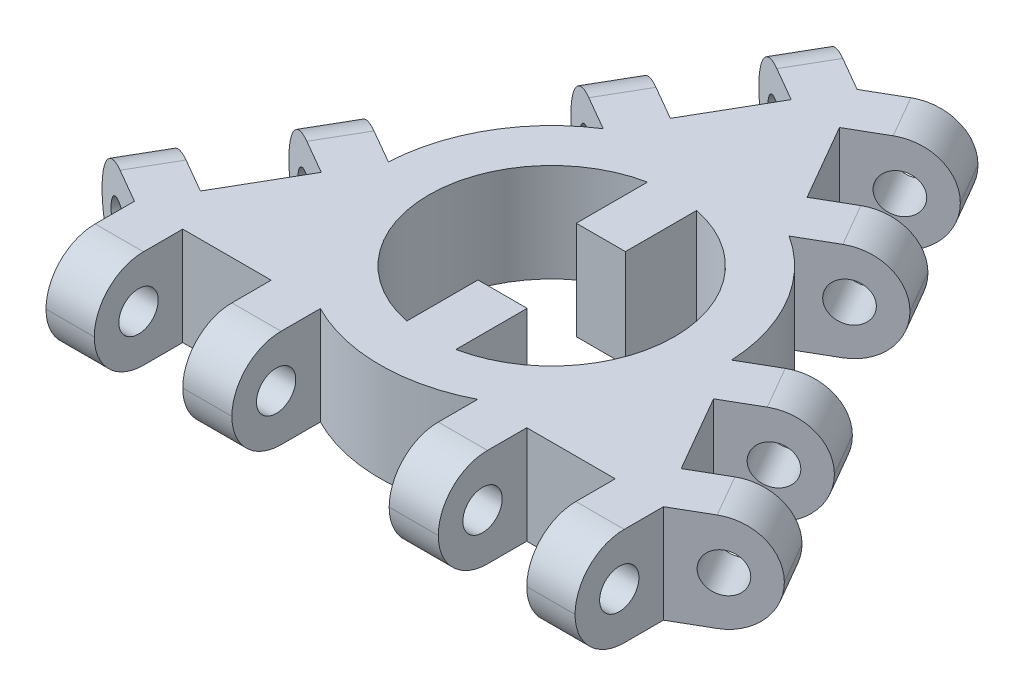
SolidWorks part; units mm, degrees
ref_plane "Ebene vorne" through (0, 0, 0) normal (0, 0, 1) x (1, 0, 0)
ref_plane "Ebene oben" through (0, 0, 0) normal (0, 1, 0) x (1, 0, 0)
ref_plane "Ebene rechts" through (0, 0, 0) normal (1, 0, 0) x (0, 0, -1)
sketch "Skizze4" plane through (0, 0, 0) normal (0, 1, 0) x (1, 0, 0)
  line L0 (-12.5, 125.5737) -> (-72.5, 21.6506)
  line L1 (12.5, 125.5737) -> (72.5, 21.6506)
  line L3 (-60, 0) -> (60, 0)
  line L4 (-12.5, 125.5737) -> (12.5, 125.5737)
  line L5 (-72.5, 21.6506) -> (-60, 0)
  line L6 (60, 0) -> (72.5, 21.6506)
  dimension "D1" = 25
  dimension "D2" = 120
extrude "Aufsatz-Linear austragen4" add sketch "Skizze4" along normal blind 20
sketch "Skizze5" plane through (0, 0, 0) normal (0, 0, 1) x (1, 0, 0)
  line L1 (-60, 20) -> (60, 20) construction
  line L2 (-44, 20) -> (-44, 0)
  line L3 (-60, 0) -> (60, 0) construction
  line L4 (-44, 0) -> (-26, 0)
  line L5 (-26, 0) -> (-26, 20)
  line L6 (-26, 20) -> (-44, 20)
  line L7 (26, 20) -> (26, 0)
  line L8 (26, 0) -> (44, 0)
  line L9 (44, 0) -> (44, 20)
  line L10 (44, 20) -> (26, 20)
  dimension "D1" = 52
  dimension "D2" = 18
  dimension "D3" = 18
extrude "Schnitt-Linear austragen3" cut sketch "Skizze5" against normal blind 18
sketch "Skizze7" plane through (63.75, 0, -36.8061) normal (0.866, 0, -0.5) x (-0.5, 0, -0.866)
  line L1 (-17.5, 20) -> (102.5, 20) construction
  line L2 (-1.5, 20) -> (-1.5, 0)
  line L3 (-17.5, 0) -> (102.5, 0) construction
  line L4 (-1.5, 0) -> (16.5, 0)
  line L5 (16.5, 0) -> (16.5, 20)
  line L6 (16.5, 20) -> (-1.5, 20)
  line L7 (68.5, 20) -> (86.5, 20)
  line L8 (86.5, 20) -> (86.5, 0)
  line L9 (86.5, 0) -> (68.5, 0)
  line L10 (68.5, 0) -> (68.5, 20)
  dimension "D1" = 52
  dimension "D2" = 18
  dimension "D3" = 18
extrude "Schnitt-Linear austragen4" cut sketch "Skizze7" against normal blind 18
sketch "Skizze8" plane through (0, 20, 0) normal (0, 1, 0) x (1, 0, 0)
  line L4 (72.5, 21.6506) -> (60, 14.4338)
  line L5 (60, 0) -> (60, 14.4338)
extrude "Schnitt-Linear austragen5" cut sketch "Skizze8" against normal through all and the other way through all
sketch "Skizze9" plane through (-63.75, 0, -36.8061) normal (-0.866, 0, -0.5) x (-0.5, 0, 0.866)
  line L1 (-102.5, 20) -> (17.5, 20) construction
  line L2 (-86.5, 20) -> (-86.5, 0)
  line L3 (-102.5, 0) -> (17.5, 0) construction
  line L4 (-86.5, 0) -> (-68.5, 0)
  line L5 (-68.5, 0) -> (-68.5, 20)
  line L6 (-68.5, 20) -> (-86.5, 20)
  line L7 (-16.5, 20) -> (1.5, 20)
  line L8 (1.5, 20) -> (1.5, 0)
  line L9 (1.5, 0) -> (-16.5, 0)
  line L10 (-16.5, 0) -> (-16.5, 20)
  dimension "D1" = 52
  dimension "D2" = 18
  dimension "D3" = 18
extrude "Schnitt-Linear austragen6" cut sketch "Skizze9" against normal blind 18
sketch "Skizze10" plane through (0, 20, 0) normal (0, 1, 0) x (1, 0, 0)
  line L0 (-60, 14.4338) -> (-72.5, 21.6506)
  line L5 (-60, 0) -> (-60, 14.4338)
extrude "Schnitt-Linear austragen7" cut sketch "Skizze10" against normal through all and the other way through all
sketch "Skizze11" plane through (0, 20, 0) normal (0, 1, 0) x (1, 0, 0)
  line L0 (0, 118.3568) -> (-12.5, 125.5737)
  line L2 (-12.5, 125.5737) -> (12.5, 125.5737)
  line L6 (12.5, 125.5737) -> (0, 118.3568)
extrude "Schnitt-Linear austragen10" cut sketch "Skizze11" against normal blind 20
sketch "Skizze12" plane through (0, 20, 0) normal (0, 1, 0) x (1, 0, 0)
  line L0 (-53.8231, 18) -> (-53.8231, 0)
  line L2 (-56.7058, 31.007) -> (-48.9115, 26.507)
  line L3 (-48.9115, 26.507) -> (-64.5, 35.507) construction
  line L4 (-60, 0) -> (-44, 0) construction
  line L5 (-53.8231, 18) -> (-69.4115, 27)
  line L6 (-64.5, 35.507) -> (-72.5, 21.6506) construction
  line L7 (-53.8231, 0) -> (-60, 0)
  line L8 (-60, 0) -> (-60, 14.4338)
  line L9 (-60, 14.4338) -> (-72.5, 21.6506)
  line L10 (-72.5, 21.6506) -> (-69.4115, 27)
extrude "Schnitt-Linear austragen11" cut sketch "Skizze12" against normal blind 20 contours L0 L5 M12 M13 M14 M15
sketch "Skizze13" plane through (0, 20, 0) normal (0, 1, 0) x (1, 0, 0)
  line L1 (53.8231, 18) -> (69.4115, 27)
  line L4 (72.5, 21.6506) -> (64.5, 35.507) construction
  line L5 (69.4115, 27) -> (72.5, 21.6506)
  line L6 (72.5, 21.6506) -> (60, 14.4338)
  line L7 (60, 14.4338) -> (60, 0)
  line L8 (53.8231, 18) -> (53.8231, 0)
  line L9 (44, 0) -> (60, 0) construction
  line L10 (53.8231, 0) -> (60, 0)
extrude "Schnitt-Linear austragen12" cut sketch "Skizze13" against normal blind 20
sketch "Skizze14" plane through (0, 20, 0) normal (0, 1, 0) x (1, 0, 0)
  line L0 (-12.7058, 107.2173) -> (-4.9115, 102.7173)
  line L1 (-4.9115, 102.7173) -> (-20.5, 111.7173) construction
  line L3 (12.7058, 107.2173) -> (4.9115, 102.7173)
  line L4 (4.9115, 102.7173) -> (20.5, 111.7173) construction
  line L6 (0, 111.2243) -> (-15.5885, 120.2243)
  line L7 (-12.5, 125.5737) -> (-20.5, 111.7173) construction
  line L8 (-15.5885, 120.2243) -> (-12.5, 125.5737)
  line L9 (-12.5, 125.5737) -> (0, 118.3568)
  line L10 (0, 118.3568) -> (12.5, 125.5737)
  line L11 (0, 111.2243) -> (15.5885, 120.2243)
  line L12 (20.5, 111.7173) -> (12.5, 125.5737) construction
  line L13 (15.5885, 120.2243) -> (12.5, 125.5737)
extrude "Schnitt-Linear austragen13" cut sketch "Skizze14" against normal blind 20 contours L6 L11 M12 M13 M14 M15
sketch "Skizze15" plane through (0, 20, 0) normal (0, 1, 0) x (1, 0, 0)
  circle A0 centre (0, 49.0748) radius 25
  dimension "D1" = 50
extrude "Schnitt-Linear austragen14" cut sketch "Skizze15" against normal blind 20
sketch "Skizze16" plane through (0, 20, 0) normal (0, 1, 0) x (1, 0, 0)
  line L5 (-18.9115, 78.4686) -> (-34.5, 87.4686)
  line L6 (-29.5, 96.1288) -> (-55.5, 51.0955) construction
  line L7 (-34.9115, 50.7558) -> (-50.5, 59.7558)
  line L8 (-50.5, 59.7558) -> (-34.5, 87.4686)
  arc A0 (-18.9115, 78.4686) -> (-34.9115, 50.7558) centre (0.0468, 49.0478) ccw
  dimension "D3" = 10
  dimension "D1" = 10
  dimension "D2" = 10
  dimension "D4" = 10
extrude "Schnitt-Linear austragen15" cut sketch "Skizze16" against normal blind 20
sketch "Skizze17" plane through (0, 20, 0) normal (0, 1, 0) x (1, 0, 0)
  line L6 (34.9115, 50.7558) -> (50.5, 59.7558)
  line L7 (55.5, 51.0955) -> (29.5, 96.1288) construction
  line L8 (18.9115, 78.4686) -> (34.5, 87.4686)
  line L9 (34.5, 87.4686) -> (50.5, 59.7558)
  arc A0 (34.9115, 50.7558) -> (18.9115, 78.4686) centre (-0.0468, 49.0478) ccw
  dimension "D3" = 10
extrude "Schnitt-Linear austragen16" cut sketch "Skizze17" against normal blind 20
sketch "Skizze18" plane through (0, 20, 0) normal (0, 1, 0) x (1, 0, 0)
  line L6 (-16, 18) -> (-16, 0)
  line L7 (-26, 0) -> (26, 0) construction
  line L8 (16, 18) -> (16, 0)
  line L9 (16, 0) -> (-16, 0)
  arc A0 (-16, 18) -> (16, 18) centre (0, 49.1288) ccw
extrude "Schnitt-Linear austragen17" cut sketch "Skizze18" against normal blind 20
sketch "Skizze19" plane through (-53.8231, 0, 0) normal (-1, 0, 0) x (0, 0, 1)
  circle A0 centre (-9, 10) radius 4
extrude "Schnitt-Linear austragen18" cut sketch "Skizze19" against normal blind 110
sketch "Skizze20" plane through (5.6615, 0, 9.8061) normal (0.5, 0, 0.866) x (0.866, 0, -0.5)
  line L0 (73.6122, 10) -> (64.6122, 10)
  line L1 (73.6122, 0) -> (73.6122, 20) construction
  circle A0 centre (64.6122, 10) radius 4
  dimension "D1" = 9
extrude "Schnitt-Linear austragen19" cut sketch "Skizze20" against normal blind 110
sketch "Skizze21" plane through (48.1615, 0, -83.4182) normal (0.5, 0, -0.866) x (-0.866, 0, -0.5)
  circle A0 centre (64.6122, 10) radius 4
extrude "Schnitt-Linear austragen20" cut sketch "Skizze21" against normal blind 110
fillet "Verrundung1" radius 10 12 edges at (-18.0442, 20, -115.9708) (-32, 20, -91.7987) (-53, 20, -55.4256) (-66.9558, 20, -31.2535) (-48.9115, 20, 0) (-21, 20, 0) (21, 20, 0) (48.9115, 20, 0) (66.9558, 20, -31.2535) (53, 20, -55.4256) (32, 20, -91.7987) (18.0442, 20, -115.9708)
fillet "Verrundung2" radius 10 12 edges at (-48.9115, 0, 0) (-21, 0, 0) (21, 0, 0) (48.9115, 0, 0) (66.9558, 0, -31.2535) (53, 0, -55.4256) (32, 0, -91.7987) (-66.9558, 0, -31.2535) (-53, 0, -55.4256) (-32, 0, -91.7987) (-18.0442, 0, -115.9708) (18.0442, 0, -115.9708)
sketch "Skizze22" plane through (0, 20, 0) normal (0, 1, 0) x (1, 0, 0)
  line L0 (-5, 59.0748) -> (-5, 73.5697)
  line L1 (5, 59.0748) -> (5, 73.5697)
  line L3 (5, 59.0748) -> (-5, 59.0748)
  line L5 (-5, 39.0748) -> (-5, 24.5799)
  line L6 (5, 39.0748) -> (5, 24.5799)
  line L8 (-5, 39.0748) -> (5, 39.0748)
  circle A0 centre (0, 49.0748) radius 25 construction
  arc A1 (-5, 24.5799) -> (5, 24.5799) centre (0, 49.0748) ccw
  arc A2 (5, 73.5697) -> (-5, 73.5697) centre (0, 49.0748) ccw
extrude "Aufsatz-Linear austragen5" add sketch "Skizze22" against normal blind 20
